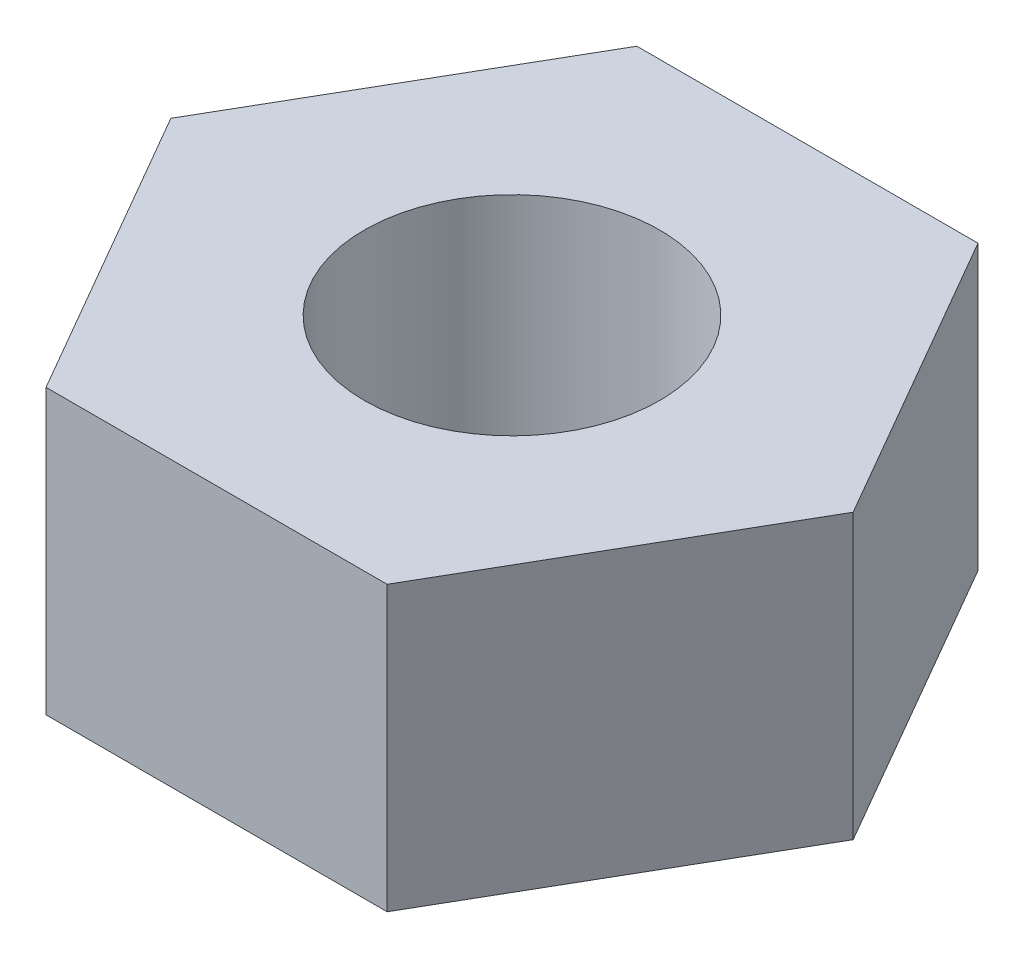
SolidWorks part; units mm, degrees
ref_plane "Plan de face" through (0, 0, 0) normal (0, 0, 1) x (1, 0, 0)
ref_plane "Plan de dessus" through (0, 0, 0) normal (0, 1, 0) x (1, 0, 0)
ref_plane "MILIEU" through (0, 0, 0) normal (1, 0, 0) x (0, 0, -1)
sketch "Esquisse1" plane through (0, 0, 0) normal (0, 1, 0) x (1, 0, 0)
  line L1 (5.7735, 0) -> (2.8868, 5)
  line L2 (2.8868, 5) -> (-2.8868, 5)
  line L3 (-2.8868, 5) -> (-5.7735, 0)
  line L4 (-5.7735, 0) -> (-2.8868, -5)
  line L5 (-2.8868, -5) -> (2.8868, -5)
  line L6 (2.8868, -5) -> (5.7735, 0)
  circle A0 centre (0, 0) radius 5 construction
  dimension "D1" = 10
extrude "Extrusion1" add sketch "Esquisse1" along normal blind 4.8
hole_wizard "Trou taraudé M6x1.01" positions "Esquisse4" profile "Esquisse3" tap size "M6x1.0" standard "ISO"
sketch "Esquisse4" plane through (0, 4.8, 0) normal (0, 1, 0) x (-1, 0, 0)
  point P0 (0, 0)
sketch "Esquisse3" plane through (0, 4.8, 0) normal (1, 0, 0) x (0, 0, 1)
  line L0 (0, 0) -> (0, 4.8)
  line L1 (0, 4.8) -> (2.5, 4.8)
  line L2 (2.5, 4.8) -> (2.5, 0)
  line L5 (2.5, 0) -> (0, 0)
  line L11 (0, -6.35) -> (0, 107.95) construction
  dimension "Diamètre du trou pour taraudage jusqu'au prochain" = 5
  dimension "Profondeur du trou pour taraudage jusqu'au prochain" = 4.8
